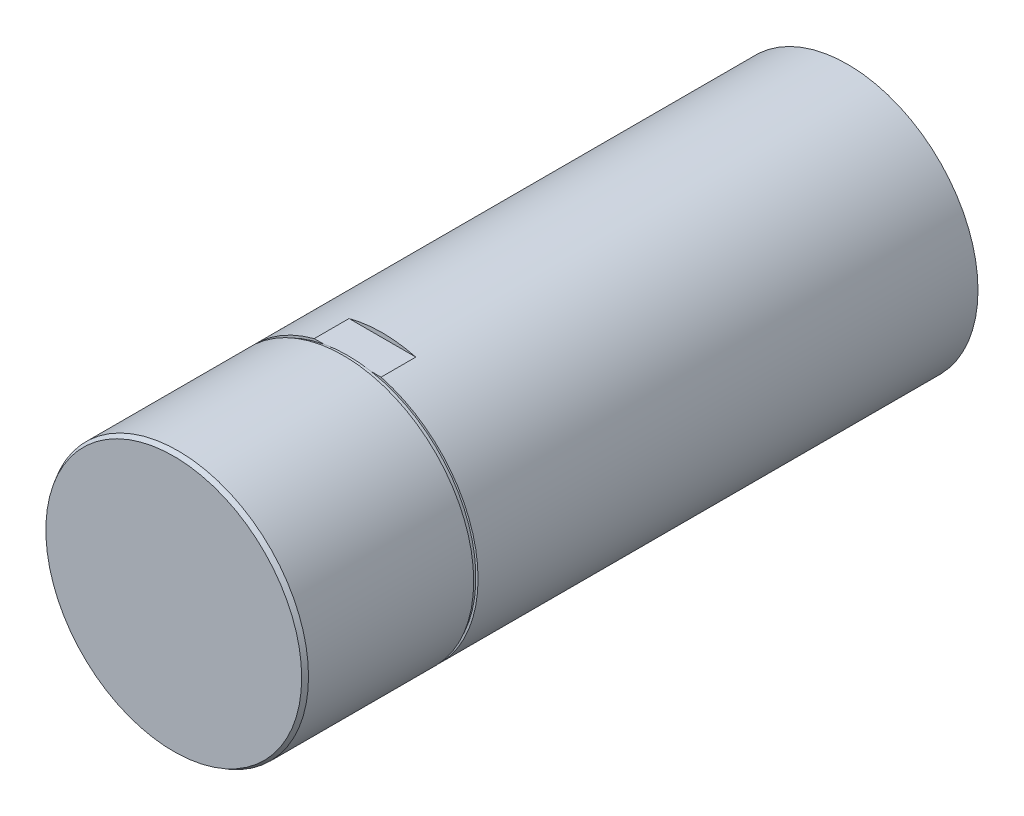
SolidWorks part; units mm, degrees
ref_plane "Front Plane" through (0, 0, 0) normal (0, 0, 1) x (1, 0, 0)
ref_plane "Top Plane" through (0, 0, 0) normal (0, 1, 0) x (1, 0, 0)
ref_plane "Right Plane" through (0, 0, 0) normal (1, 0, 0) x (0, 0, -1)
sketch "Sketch1" plane through (0, 0, 0) normal (0, 0, 1) x (1, 0, 0)
  circle A0 centre (0, 0) radius 30
  dimension "D1" = 60
extrude "STROKE" add sketch "Sketch1" against normal blind 100
sketch "Sketch2" plane through (0, 0, 0) normal (0, 0, 1) x (1, 0, 0)
  circle A0 centre (0, 0) radius 30
  dimension "D1" = 60
extrude "L2" add sketch "Sketch2" along normal blind 15
ref_plane "Plane1" through (0, 0, 15) normal (0, 0, 1) x (1, 0, 0)
sketch "Sketch3" plane through (0, 0, 15) normal (0, 0, 1) x (1, 0, 0)
  circle A0 centre (0, 0) radius 30
  dimension "D1" = 60
extrude "L3" add sketch "Sketch3" along normal blind 40
chamfer "Chamfer2" distance 1 angle 30 1 edges at (30, 0, 55)
sketch "Sketch5" plane through (0, 0, 15) normal (0, 0, 1) x (1, 0, 0)
  circle A0 centre (0, 0) radius 30
  circle A1 centre (0, 0) radius 29.5
  circle A4 centre (0, 0) radius 30 construction
  dimension "D1" = 60
  dimension "D2" = 59
extrude "U/C" cut sketch "Sketch5" along normal blind 1
sketch "Sketch6" plane through (0, 0, 0) normal (1, 0, 0) x (0, 0, -1)
  line L0 (-55, 29.4226) -> (-55, -29.4226) construction
  line L1 (-15, 30.5) -> (-7, 30.5)
  line L2 (-15, -29) -> (-15, -30.5)
  line L3 (-15, 29) -> (-7, 29)
  line L4 (-7, 30.5) -> (-7, 29)
  line L5 (-15, -29) -> (-7, -29)
  line L6 (-15, 30.5) -> (-15, 29)
  line L7 (-15, -30.5) -> (-7, -30.5)
  line L8 (-7, -29) -> (-7, -30.5)
  line L9 (100, -30) -> (100, 30) construction
  line L10 (100, 0) -> (-15, 0) construction
  line L12 (100, 0) -> (-15, 0) construction
  dimension "D1" = 8
  dimension "D2" = 58
  dimension "D3" = 29
  dimension "D4" = 40
  dimension "D5" = 61
  dimension "D6" = 60
  dimension "D7" = 30.5
extrude "A/F" cut sketch "Sketch6" against normal mid plane 21
equation "\"D2@Sketch5\" = \"D1@Sketch5\" - 1"
equation "\"D5@Sketch6\" = \"D2@Sketch6\"+3"
equation "\"D3@Sketch6\" = \"D2@Sketch6\" / 2"
equation "\"D2@Sketch6\" = \"D6@Sketch6\"-2"
equation "\"D7@Sketch6\" = \"D5@Sketch6\"/2"
